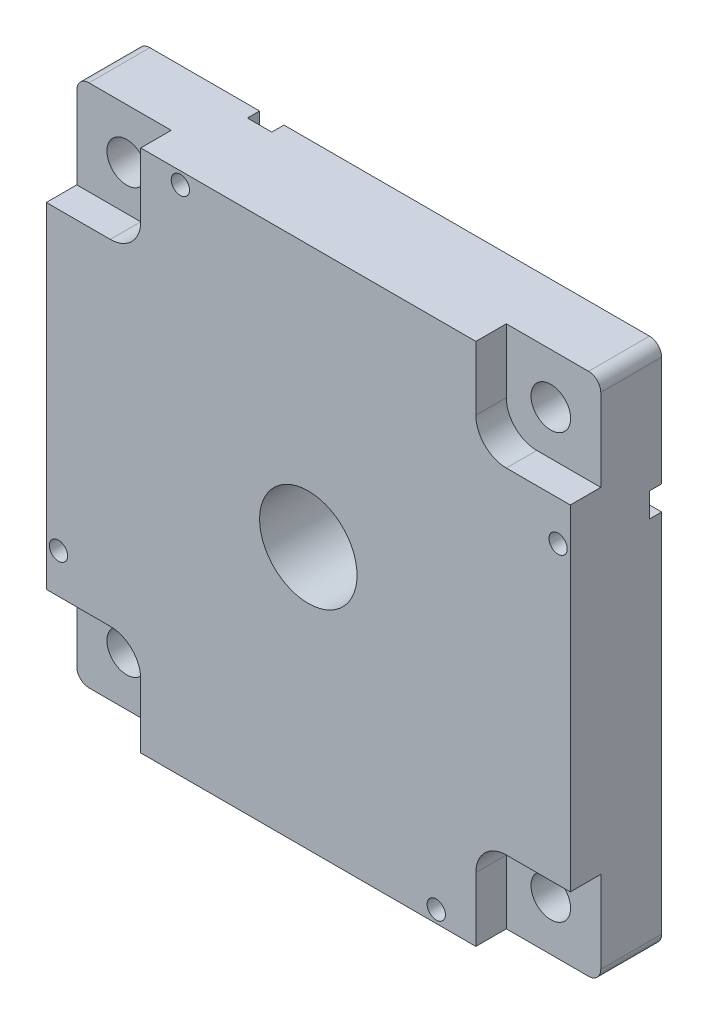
SolidWorks part; units mm, degrees
ref_plane "前视" through (0, 0, 0) normal (0, 0, 1) x (1, 0, 0)
ref_plane "上视" through (0, 0, 0) normal (0, 1, 0) x (1, 0, 0)
ref_plane "右视" through (0, 0, 0) normal (1, 0, 0) x (0, 0, -1)
sketch "草图2" plane through (0, 0, 0) normal (0, 0, 1) x (1, 0, 0)
  line L1 (43, -43) -> (-43, -43)
  line L2 (43, -43) -> (43, 43)
  line L3 (43, 43) -> (-43, 43)
  line L4 (-43, -43) -> (-43, 43)
  line L5 (43, -43) -> (-43, 43) construction
  line L6 (43, 43) -> (-43, -43) construction
  point P0 (0, 0)
  dimension "D1" = 86
  dimension "D2" = 86
extrude "凸台-拉伸1" add sketch "草图2" along normal blind 10
sketch "草图3" plane through (0, 0, 0) normal (0, 0, -1) x (-1, 0, 0)
  line L1 (34.8, -34.8) -> (-34.8, -34.8)
  line L2 (34.8, -34.8) -> (34.8, 34.8)
  line L5 (34.8, -34.8) -> (-34.8, 34.8) construction
  line L6 (34.8, 34.8) -> (-34.8, -34.8) construction
  circle A0 centre (-34.8, 34.8) radius 3.25
  point P0 (0, 0)
  dimension "D1" = 69.6
  dimension "D2" = 69.6
extrude "切除-拉伸1" cut sketch "草图3" against normal blind 10 contours A0
sketch "草图4" plane through (0, 0, 0) normal (0, 0, -1) x (-1, 0, 0)
  circle A0 centre (0, 0) radius 36.5
  circle A1 centre (0, 0) radius 37
extrude "切除-拉伸2" cut sketch "草图4" against normal blind 0.5
sketch "草图5" plane through (0, 0, 0) normal (0, 0, -1) x (-1, 0, 0)
  circle A0 centre (0, 0) radius 36.5
extrude "凸台-拉伸2" add sketch "草图5" along normal blind 1.6
sketch "草图6" plane through (0, 0, -1.6) normal (0, 0, -1) x (-1, 0, 0)
  circle A0 centre (0, 0) radius 20
  circle A1 centre (0, 0) radius 21
extrude "切除-拉伸3" cut sketch "草图6" against normal blind 0.5
sketch "草图7" plane through (0, 0, -1.6) normal (0, 0, -1) x (-1, 0, 0)
  circle A0 centre (0, 0) radius 8
extrude "切除-拉伸4" cut sketch "草图7" against normal blind 80
pattern_circular "阵列(圆周)1" count 4 over 360 about axis through (0, 0, 0) along (0, 0, 1) of "切除-拉伸1"
fillet "圆角1" radius 2 1 edges at (43, 43, 5)
fillet "圆角2" radius 2 1 edges at (-43, 43, 5)
fillet "圆角3" radius 2 1 edges at (-43, -43, 5)
fillet "圆角4" radius 2 1 edges at (43, -43, 5)
sketch "草图8" plane through (0, 0, 10) normal (0, 0, 1) x (1, 0, 0)
  line L0 (41, 43) -> (-41, 43) construction
  line L1 (27.5, -43) -> (-27.5, -43)
  line L2 (27.5, -43) -> (27.5, -27.5)
  line L3 (27.5, 43) -> (-27.5, 43)
  line L4 (-27.5, -43) -> (-27.5, -27.5)
  line L5 (27.5, -43) -> (-27.5, 43) construction
  line L6 (27.5, 43) -> (-27.5, -43) construction
  line L7 (-43, 41) -> (-43, -41) construction
  line L8 (43, -27.5) -> (27.5, -27.5)
  line L9 (43, -27.5) -> (43, 27.5)
  line L10 (43, 27.5) -> (27.5, 27.5)
  line L11 (-43, -27.5) -> (-43, 27.5)
  line L12 (43, -27.5) -> (-43, 27.5) construction
  line L13 (43, 27.5) -> (-43, -27.5) construction
  line L14 (-27.5, 27.5) -> (-27.5, 43)
  line L15 (-27.5, -27.5) -> (-43, -27.5)
  line L16 (27.5, 27.5) -> (27.5, 43)
  line L17 (-27.5, 27.5) -> (-43, 27.5)
  point P0 (0, 0)
  point P8 (0, 0)
  dimension "D1" = 55
  dimension "D2" = 55
extrude "凸台-拉伸3" add sketch "草图8" along normal blind 5
fillet "圆角5" radius 5 2 edges at (27.5, 27.5, 12.5)
sketch "草图9" plane through (0, 0, 15) normal (0, 0, 1) x (1, 0, 0)
  circle A0 centre (0, 0) radius 8
extrude "切除-拉伸5" cut sketch "草图9" against normal blind 5
fillet "圆角6" radius 5 2 edges at (-27.5, 27.5, 12.5)
fillet "圆角7" radius 5 2 edges at (-27.5, -27.5, 12.5)
fillet "圆角8" radius 5 2 edges at (27.5, -27.5, 12.5)
sketch "草图10" plane through (0, 0, 0) normal (0, 0, -1) x (-1, 0, 0)
  line L2 (23, 41) -> (23, 43)
  line L3 (-41, 43) -> (41, 43) construction
  line L5 (19, 41) -> (19, 43)
  line L6 (19, 43) -> (23, 43)
  arc A0 (19, 41) -> (23, 41) centre (21, 41) ccw
  dimension "D2" = 2
  dimension "D3" = 4
extrude "切除-拉伸6" cut sketch "草图10" against normal blind 2
pattern_circular "阵列(圆周)2" count 4 over 360 about axis through (0, 0, 0) along (0, 0, 1) of "切除-拉伸6"
sketch "草图11" plane through (0, 0, 0) normal (0, 0, -1) x (-1, 0, 0)
  circle A0 centre (21, 41) radius 1.5
extrude "切除-拉伸7" cut sketch "草图11" against normal blind 50
pattern_circular "阵列(圆周)3" count 4 over 360 about axis through (0, 0, 0) along (0, 0, 1) of "切除-拉伸7"
